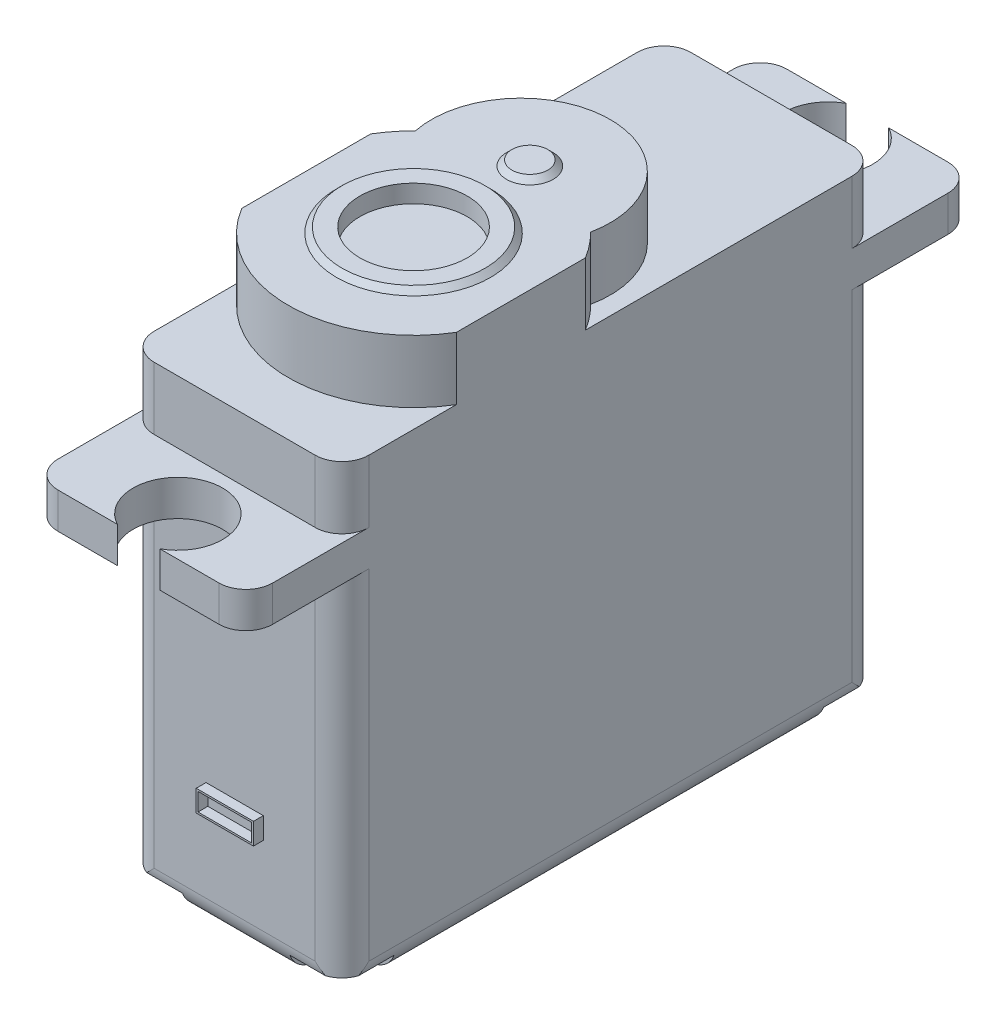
SolidWorks part; units mm, degrees
ref_plane "Front Plane" through (0, 0, 0) normal (0, 0, 1) x (1, 0, 0)
ref_plane "Top Plane" through (0, 0, 0) normal (0, 1, 0) x (1, 0, 0)
ref_plane "Right Plane" through (0, 0, 0) normal (1, 0, 0) x (0, 0, -1)
sketch "Sketch1" plane through (0, 0, 0) normal (0, 1, 0) x (1, 0, 0)
  line L1 (-6, -15) -> (6, -15)
  line L2 (-6, -15) -> (-6, 15)
  line L3 (-6, 15) -> (6, 15)
  line L4 (6, -15) -> (6, 15)
  line L5 (-6, -15) -> (6, 15) construction
  line L6 (-6, 15) -> (6, -15) construction
  point P0 (0, 0)
  dimension "D1" = 12
  dimension "D2" = 30
extrude "Boss-Extrude1" add sketch "Sketch1" along normal blind 22.5
sketch "Sketch2" plane through (0, 22.5, 0) normal (0, 1, 0) x (1, 0, 0)
  line L0 (6, -15) -> (6, 15) construction
  line L1 (-6, -20.375) -> (6, -20.375)
  line L2 (-6, -20.375) -> (-6, 20.375)
  line L3 (-6, 20.375) -> (6, 20.375)
  line L4 (6, -20.375) -> (6, 20.375)
  line L5 (-6, -20.375) -> (6, 20.375) construction
  line L6 (-6, 20.375) -> (6, -20.375) construction
  point P0 (0, 0)
  dimension "D1" = 40.75
  dimension "D2" = 0
extrude "Boss-Extrude2" add sketch "Sketch2" against normal blind 2
sketch "Sketch3" plane through (0, 22.5, 0) normal (0, 1, 0) x (1, 0, 0)
  line L0 (6, -20.375) -> (6, 20.375) construction
  line L1 (-6, -15) -> (6, -15)
  line L2 (-6, -15) -> (-6, 15)
  line L3 (-6, 15) -> (6, 15)
  line L4 (6, -15) -> (6, 15)
  line L5 (-6, -15) -> (6, 15) construction
  line L6 (-6, 15) -> (6, -15) construction
  line L7 (6, 15) -> (-6, 15) construction
  point P0 (0, 0)
  dimension "D1" = 0
extrude "Boss-Extrude3" add sketch "Sketch3" along normal blind 3.5
sketch "Sketch5" plane through (0, 22.5, 0) normal (0, 1, 0) x (1, 0, 0)
  line L0 (0, -20.375) -> (0, -18.175) construction
  line L1 (-6, -20.375) -> (6, -20.375) construction
  circle A0 centre (0, -18.175) radius 2.5
  dimension "D2" = 5
  dimension "D1" = 2.2
extrude "Cut-Extrude1" cut sketch "Sketch5" against normal up to next
sketch "Sketch6" plane through (0, 22.5, 0) normal (0, 1, 0) x (1, 0, 0)
  line L0 (0, 20.375) -> (0, 18.175) construction
  line L1 (6, 20.375) -> (-6, 20.375) construction
  circle A0 centre (0, 18.175) radius 2.5
  dimension "D2" = 5
  dimension "D1" = 2.2
extrude "Cut-Extrude2" cut sketch "Sketch6" against normal up to next
sketch "Sketch7" plane through (0, 26, 0) normal (0, 1, 0) x (1, 0, 0)
  line L0 (0, -15) -> (0, -5) construction
  line L1 (-6, -15) -> (6, -15) construction
  line L2 (6, -15) -> (6, 15) construction
  line L3 (6, -8.6056) -> (6, -1.3944)
  line L4 (-6, -8.6056) -> (-6, -1.3944)
  line L5 (-6, 15) -> (-6, -15) construction
  line L6 (0, -5) -> (0, 1) construction
  arc A0 (6, -1.3944) -> (4.899, 0) centre (0, -5) ccw
  arc A1 (-6, -8.6056) -> (6, -8.6056) centre (0, -5) ccw
  arc A2 (4.899, 0) -> (-4.899, 0) centre (0, 1) ccw
  arc A3 (-4.899, 0) -> (-6, -1.3944) centre (0, -5) ccw
  dimension "D2" = 14
  dimension "D4" = 10
  dimension "D1" = 10
  dimension "D3" = 6
extrude "Boss-Extrude5" add sketch "Sketch7" along normal blind 3.5
sketch "Sketch10" plane through (0, 29.5, 0) normal (0, 1, 0) x (1, 0, 0)
  circle A0 centre (0, -5) radius 4.5
  dimension "D1" = 9
extrude "Boss-Extrude6" add sketch "Sketch10" along normal blind 0.3
sketch "Sketch14" plane through (0, 29.5, 0) normal (0, 1, 0) x (1, 0, 0)
  line L0 (0, -9.5) -> (0, 1.5) construction
  circle A0 centre (0, -5) radius 4.5 construction
  circle A1 centre (0, 1.5) radius 1.5
  dimension "D2" = 3
  dimension "D1" = 11
extrude "Boss-Extrude9" add sketch "Sketch14" along normal blind 0.3 contours A1
sketch "Sketch15" plane through (0, 0, 0) normal (0, -1, 0) x (-1, 0, 0)
  line L0 (-6, -15) -> (-4.5, -15) construction
  line L1 (6, -15) -> (-6, -15) construction
  line L2 (-4.5, -15) -> (-4.5, -13.5) construction
  line L3 (-4.5, -12) -> (-6, -12)
  line L4 (-6, -15) -> (-6, 15) construction
  line L5 (-6, -12) -> (-6, -15)
  line L6 (-6, -15) -> (-3, -15)
  line L7 (-6, -15) -> (6, -15) construction
  line L8 (-3, -15) -> (-3, -13.5)
  arc A0 (-3, -13.5) -> (-4.5, -12) centre (-4.5, -13.5) ccw
  dimension "D4" = 1.5
  dimension "D1" = 1.5
  dimension "D2" = 1.5
  dimension "D3" = 3
  dimension "D5" = 1.5
extrude "Cut-Extrude4" cut sketch "Sketch15" against normal blind 1
mirror "Mirror3" about plane through (0, 0, 0) normal (1, 0, 0) of "Cut-Extrude4"
mirror "Mirror4" about plane through (0, 0, 0) normal (0, 0, 1) of "Mirror3", "Cut-Extrude4"
sketch "Sketch16" plane through (0, 29.8, 0) normal (0, 1, 0) x (1, 0, 0)
  circle A0 centre (0, -5) radius 3
  dimension "D1" = 6
extrude "Cut-Extrude5" cut sketch "Sketch16" against normal blind 1
fillet "Fillet2" radius 1.5 16 edges at (6, 21.5, -20.375) (-6, 21.5, -20.375) (-6, 21.5, 20.375) (6, 21.5, 20.375) (6, 0, 0) (0, 0, -15) (-6, 0, 0) (0, 0, 15) (6, 10.75, -15) (-6, 10.75, -15) (-6, 10.75, 15) (6, 10.75, 15)
chamfer "Chamfer2" distance 0.5 angle 45 1 edges at (0, 29.8, 9.5)
chamfer "Chamfer3" distance 0.5 angle 45 1 edges at (0, 29.8, 0)
sketch "Sketch17" plane through (0, 0, 15) normal (0, 0, 1) x (1, 0, 0)
  line L0 (0, 0) -> (0, 6.5) construction
  line L2 (1.6, 5.9) -> (-1.6, 5.9)
  line L3 (1.6, 5.9) -> (1.6, 7.1)
  line L4 (1.6, 7.1) -> (-1.6, 7.1)
  line L5 (-1.6, 5.9) -> (-1.6, 7.1)
  line L6 (1.6, 5.9) -> (-1.6, 7.1) construction
  line L7 (1.6, 7.1) -> (-1.6, 5.9) construction
  dimension "D1" = 6.5
  dimension "D2" = 1.2
  dimension "D3" = 3.2
extrude "Boss-Extrude11" add sketch "Sketch17" along normal blind 0.55
sketch "Sketch22" plane through (0, 0, 15.55) normal (0, 0, 1) x (1, 0, 0)
  line L0 (1.6, 7.1) -> (-1.6, 7.1) construction
  line L1 (-1.5, 7) -> (1.5, 7)
  line L2 (-1.5, 7) -> (-1.5, 6)
  line L3 (-1.5, 6) -> (1.5, 6)
  line L4 (1.5, 7) -> (1.5, 6)
  line L5 (-1.5, 7) -> (1.5, 6) construction
  line L6 (-1.5, 6) -> (1.5, 7) construction
  line L7 (1.6, 5.9) -> (1.6, 7.1) construction
  line L8 (-1.6, 7.1) -> (-1.6, 5.9) construction
  line L9 (-1.6, 5.9) -> (1.6, 5.9) construction
  point P0 (0, 6.5)
  dimension "D1" = 0.1
  dimension "D2" = 0.1
  dimension "D3" = 0.1
  dimension "D4" = 0.1
extrude "Cut-Extrude7" cut sketch "Sketch22" against normal up to surface (0.55 mm away) contours L1 L4 L3 L2
